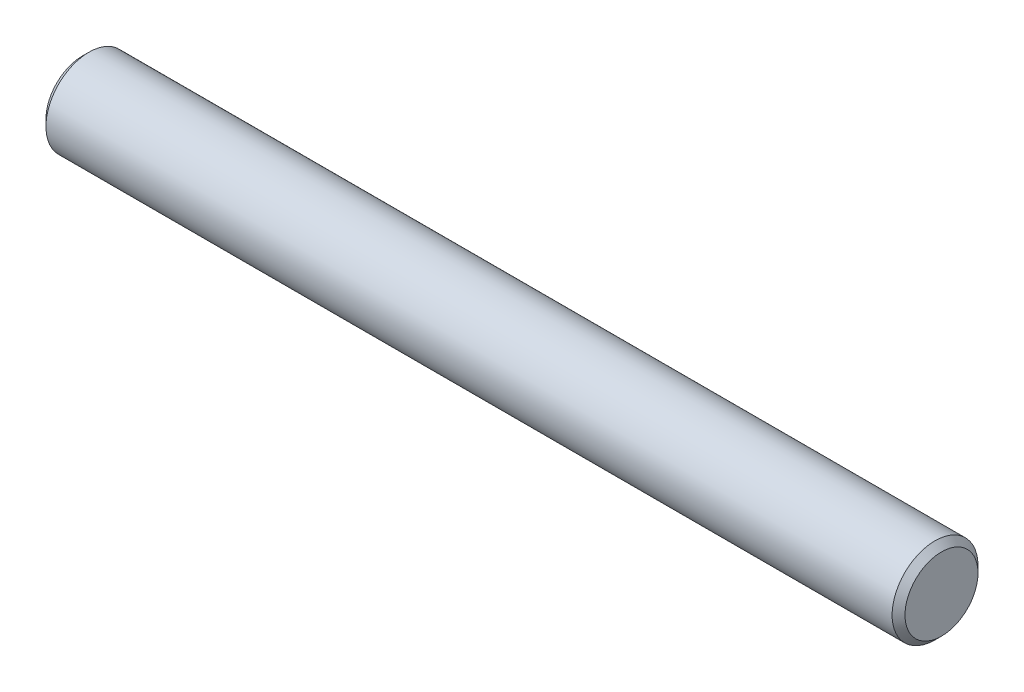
SolidWorks part; units mm, degrees
ref_plane "Plan de face" through (0, 0, 0) normal (0, 0, 1) x (1, 0, 0)
ref_plane "Plan de dessus" through (0, 0, 0) normal (0, 1, 0) x (1, 0, 0)
ref_plane "Plan de droite" through (0, 0, 0) normal (1, 0, 0) x (0, 0, -1)
sketch "Esquisse1" plane through (0, 0, 0) normal (1, 0, 0) x (0, 0, -1)
  circle A0 centre (0, 0) radius 2
extrude "Boss.-Extru.1" add sketch "Esquisse1" along normal blind 40
chamfer "Chanfrein1" distance 0.3 angle 45 2 edges at (0, 0, -2) (40, 0, -2)
